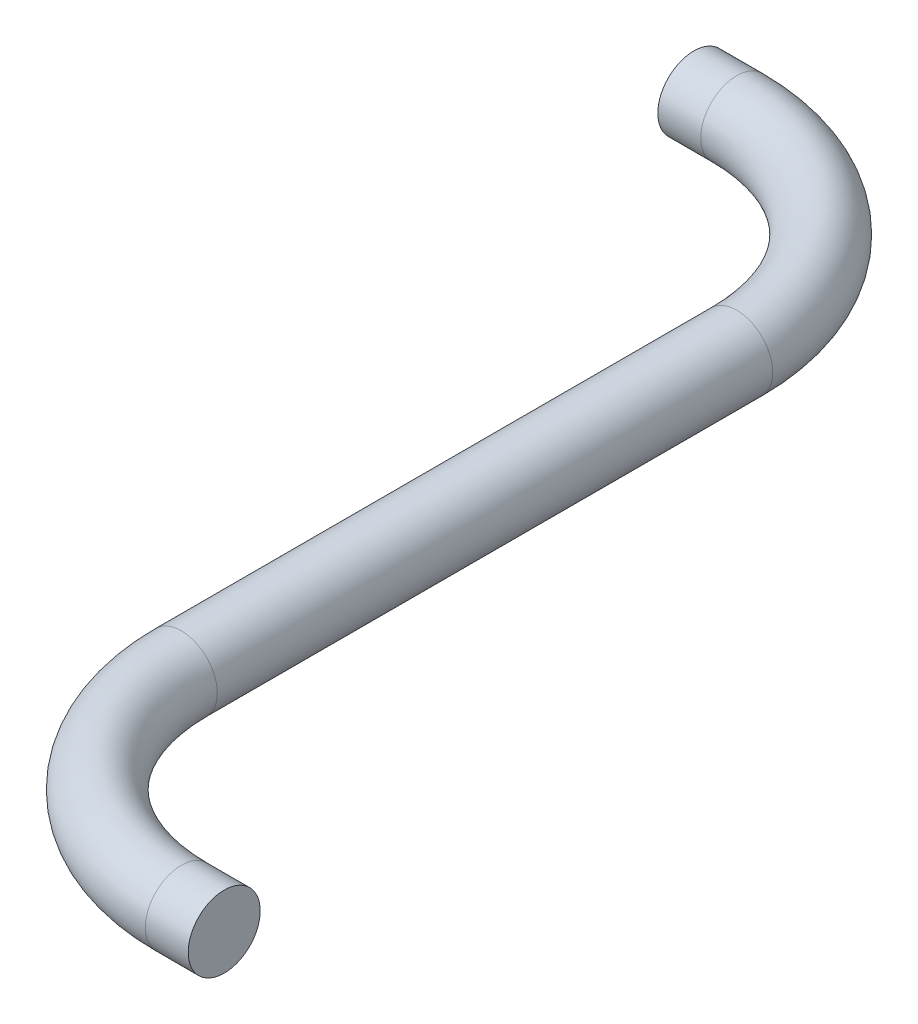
SolidWorks part; units mm, degrees
ref_plane "Front Plane" through (0, 0, 0) normal (0, 0, 1) x (1, 0, 0)
ref_plane "Top Plane" through (0, 0, 0) normal (0, 1, 0) x (1, 0, 0)
ref_plane "Right Plane" through (0, 0, 0) normal (1, 0, 0) x (0, 0, -1)
sketch "Sketch1" plane through (0, 0, 0) normal (1, 0, 0) x (0, 0, -1)
  circle A0 centre (0, 1.5875) radius 1.5875
  dimension "D1" = 3.175
sketch "Sketch2" plane through (0, 0, 0) normal (0, 1, 0) x (1, 0, 0)
  line L0 (0, 0) -> (1.892, 0)
  line L1 (10.8458, -8.9538) -> (10.8458, -33.4445)
  line L2 (21.6916, -42.3983) -> (19.7996, -42.3983)
  arc A0 (10.8458, -8.9538) -> (1.892, 0) centre (1.892, -8.9538) ccw
  arc A1 (19.7996, -42.3983) -> (10.8458, -33.4445) centre (19.7996, -33.4445) cw
  point P7 (21.6916, -42.3983)
  dimension "D1" = 8.9538
  dimension "D4" = 47.625
  dimension "D5" = 21.6916
sweep "Sweep1" add profiles "Sketch1" path "Sketch2"
